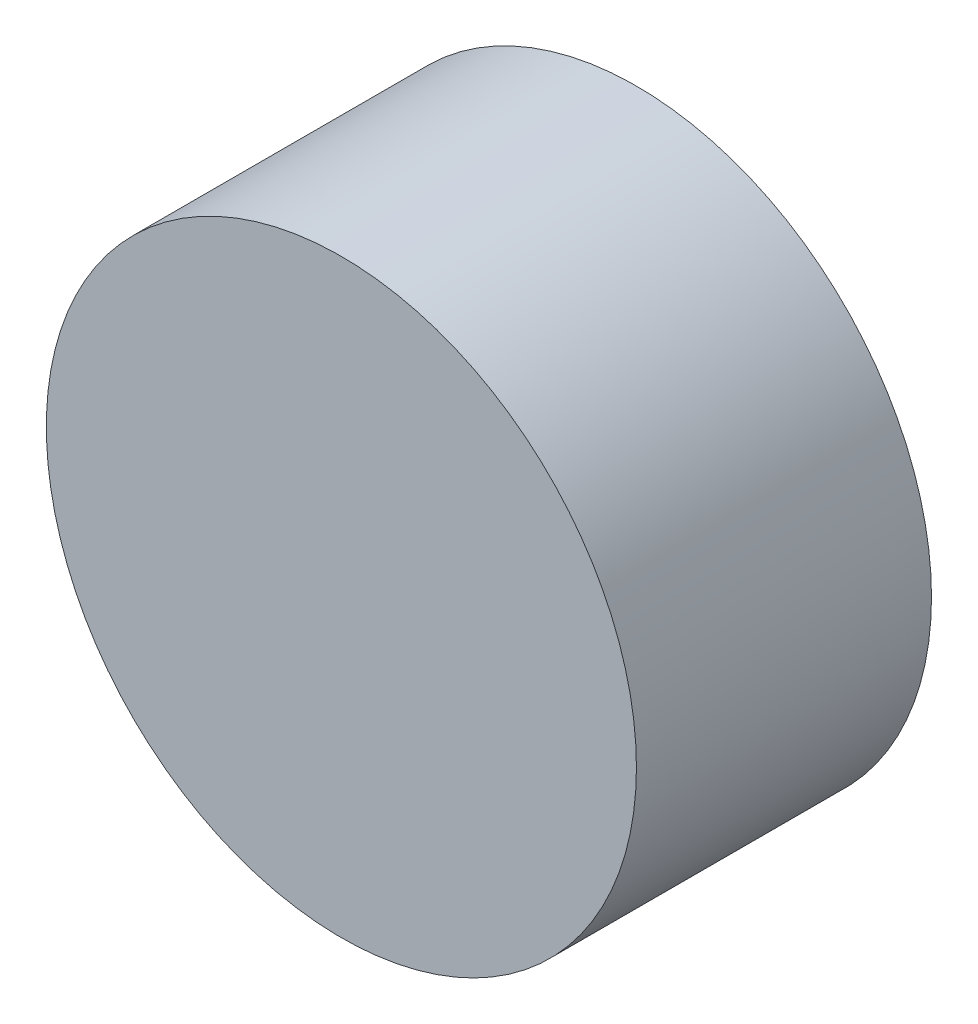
SolidWorks part; units mm, degrees
ref_plane "Front Plane" through (0, 0, 0) normal (0, 0, 1) x (1, 0, 0)
ref_plane "Top Plane" through (0, 0, 0) normal (0, 1, 0) x (1, 0, 0)
ref_plane "Right Plane" through (0, 0, 0) normal (1, 0, 0) x (0, 0, -1)
sketch "Sketch1" plane through (0, 0, 0) normal (0, 0, 1) x (1, 0, 0)
  circle A0 centre (0, 0) radius 25.4
  dimension "D1" = 50.8
extrude "Extrude1" add sketch "Sketch1" along normal blind 25.4
